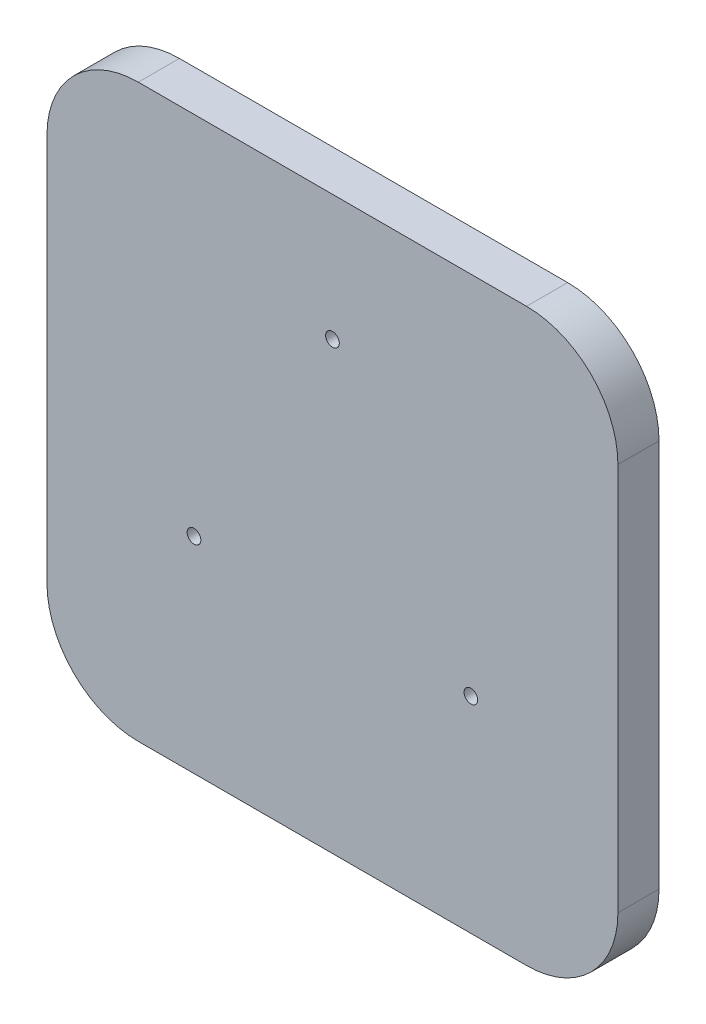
SolidWorks part; units mm, degrees
ref_plane "Plan de face" through (0, 0, 0) normal (0, 0, 1) x (1, 0, 0)
ref_plane "Plan de dessus" through (0, 0, 0) normal (0, 1, 0) x (1, 0, 0)
ref_plane "Plan de droite" through (0, 0, 0) normal (1, 0, 0) x (0, 0, -1)
sketch "Esquisse1" plane through (0, 0, 0) normal (0, 0, 1) x (1, 0, 0)
  line L1 (0, 0) -> (250, 0)
  line L2 (0, 0) -> (0, 250)
  line L3 (0, 250) -> (250, 250)
  line L4 (250, 0) -> (250, 250)
  dimension "D1" = 250
extrude "Boss.-Extru.1" add sketch "Esquisse1" along normal blind 18
sketch "Esquisse2" plane through (0, 0, 18) normal (0, 0, 1) x (1, 0, 0)
  line L0 (0, 250) -> (250, 0) construction
  circle A0 centre (125, 125) radius 70 construction
  circle A1 centre (125, 195) radius 3
  circle A2 centre (185.6218, 90) radius 3
  circle A3 centre (64.3782, 90) radius 3
  point P14 (125, 125)
  dimension "D1" = 140
  dimension "D2" = 6
  dimension "D3" = 3
extrude "Enlèv. mat.-Extru.1" cut sketch "Esquisse2" against normal blind 18
fillet "Congé1" radius 40 4 edges at (250, 0, 9) (0, 0, 9) (250, 250, 9) (0, 250, 9)
